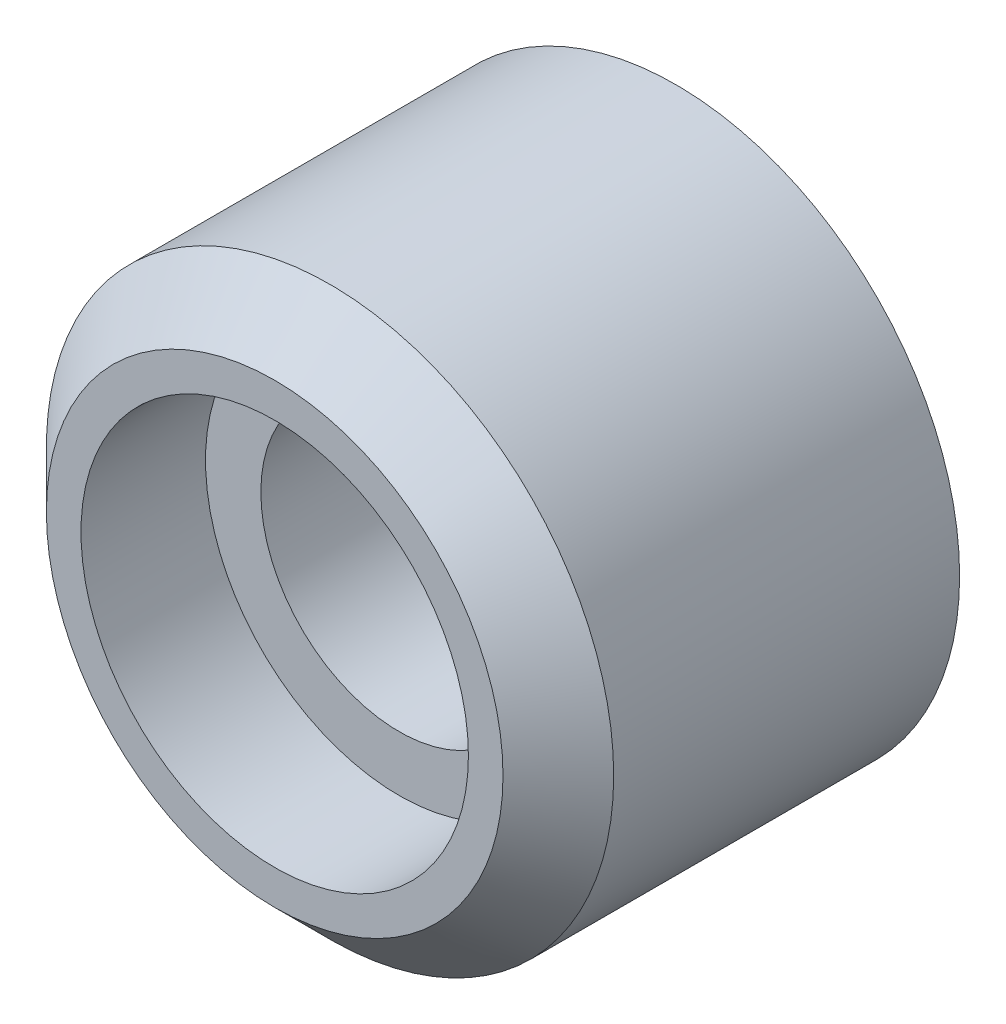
SolidWorks part; units mm, degrees
ref_plane "Ebene vorne" through (0, 0, 0) normal (0, 0, 1) x (1, 0, 0)
ref_plane "Ebene oben" through (0, 0, 0) normal (0, 1, 0) x (1, 0, 0)
ref_plane "Ebene rechts" through (0, 0, 0) normal (1, 0, 0) x (0, 0, -1)
sketch "Skizze1" plane through (0, 0, 0) normal (0, 0, 1) x (1, 0, 0)
  circle A0 centre (0, 0) radius 10.25
  dimension "D1" = 20.5
extrude "Aufsatz-Linear austragen1" add sketch "Skizze1" against normal blind 14.5
sketch "Skizze2" plane through (0, 0, 0) normal (0, 0, 1) x (1, 0, 0)
  circle A0 centre (0, 0) radius 5
  dimension "D1" = 10
extrude "Schnitt-Linear austragen1" cut sketch "Skizze2" against normal through all
sketch "Skizze3" plane through (0, 0, 0) normal (0, 0, 1) x (1, 0, 0)
  circle A0 centre (0, 0) radius 7
  dimension "D1" = 14
extrude "Schnitt-Linear austragen2" cut sketch "Skizze3" against normal blind 4.5
chamfer "Fase1" distance 2 angle 45 1 edges at (10.25, 0, 0)
